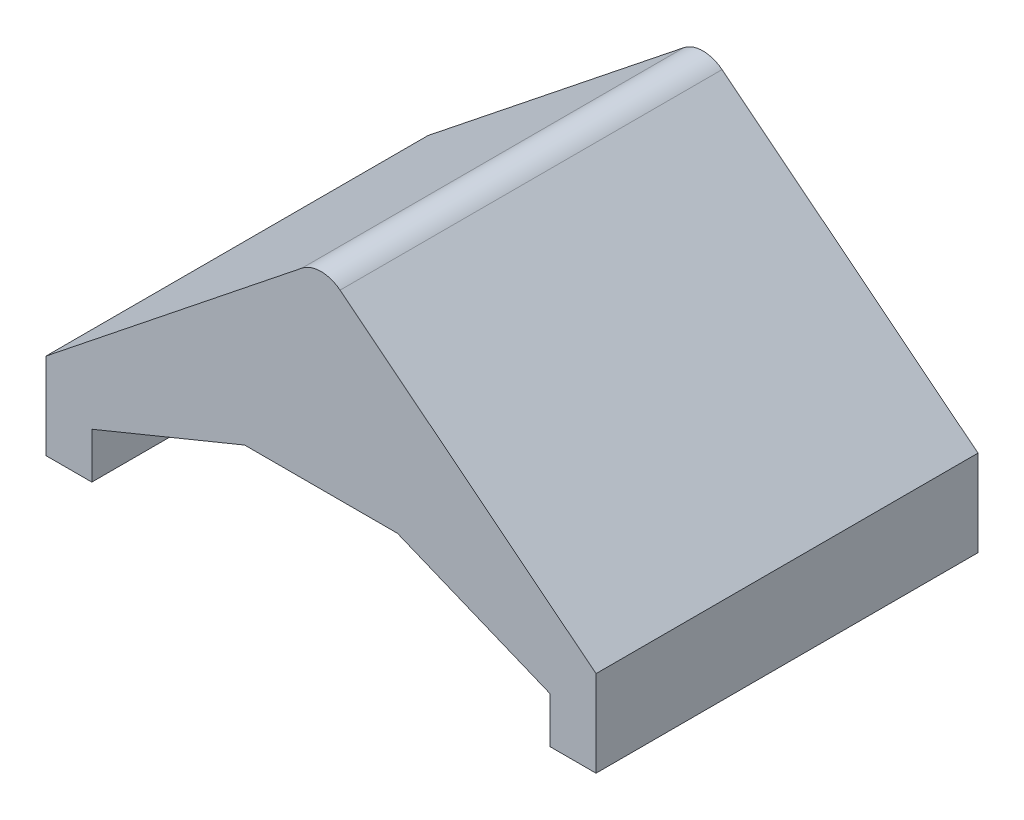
SolidWorks part; units mm, degrees
ref_plane "Front Plane" through (0, 0, 0) normal (0, 0, 1) x (1, 0, 0)
ref_plane "Top Plane" through (0, 0, 0) normal (0, 1, 0) x (1, 0, 0)
ref_plane "Right Plane" through (0, 0, 0) normal (1, 0, 0) x (0, 0, -1)
sketch "Sketch1" plane through (0, 0, 0) normal (0, 0, 1) x (1, 0, 0)
  line L0 (0, 0) -> (3, 0)
  line L1 (3, 0) -> (3, 3)
  line L2 (3, 3) -> (13, 7.1)
  line L3 (13, 7.1) -> (23, 7.1)
  line L4 (33, 3) -> (33, 0)
  line L5 (33, 0) -> (36, 0)
  line L6 (36, 0) -> (36, 5.6458)
  line L7 (36, 5.6458) -> (18, 20)
  line L8 (18, 20) -> (0, 5.6458)
  line L9 (0, 5.6458) -> (0, 0)
  line L10 (23, 7.1) -> (33, 3)
  dimension "D1" = 3
  dimension "D2" = 30
  dimension "D3" = 20
  dimension "D4" = 7.1
  dimension "D5" = 3
  dimension "D6" = 4
  dimension "D7" = 10
extrude "Boss-Extrude1" add sketch "Sketch1" along normal blind 25
fillet "Fillet1" radius 2 1 edges at (18, 20, 12.5)
sketch "Sketch2" plane through (0, 7.1, 0) normal (0, -1, 0) x (1, 0, 0)
  line L0 (18, 25) -> (18, 0) construction
  line L1 (13, 25) -> (23, 25) construction
  line L2 (13, 0) -> (23, 0) construction
  circle A0 centre (18, 12.5) radius 3.25
  dimension "D1" = 6.5
extrude "Cut-Extrude1" cut sketch "Sketch2" against normal blind 8
chamfer "Chamfer1" distance 0.5 angle 45 1 edges at (18, 7.1, 9.25)
